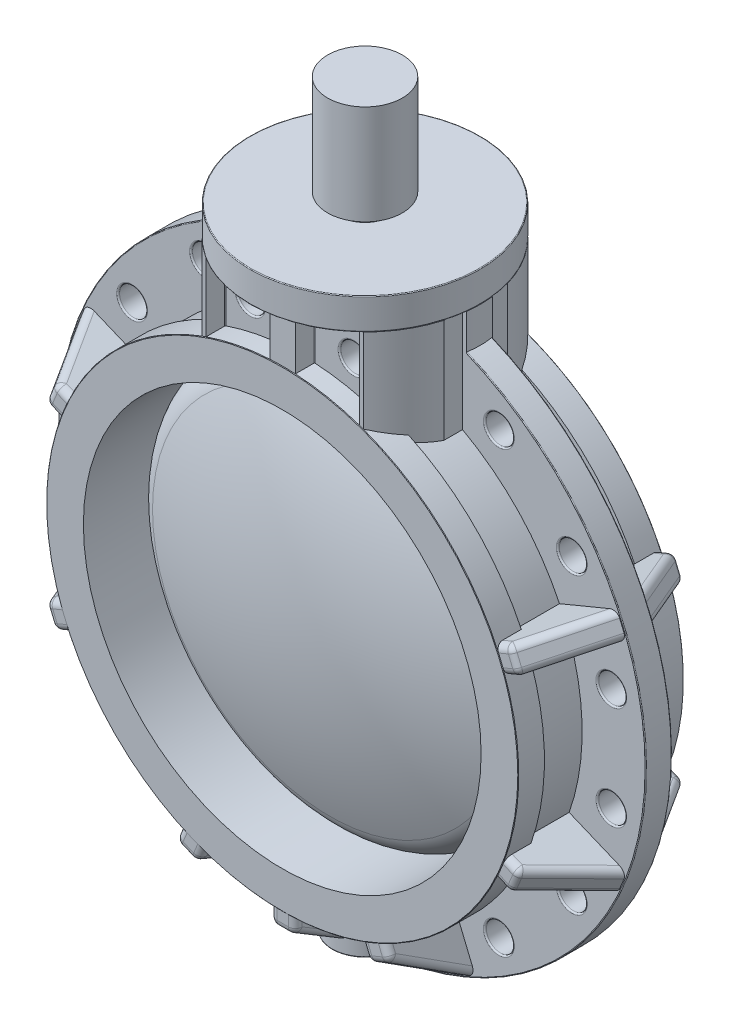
SolidWorks part; units mm, degrees
ref_plane "Front" through (0, 0, 0) normal (0, 0, 1) x (1, 0, 0)
ref_plane "Top" through (0, 0, 0) normal (0, 1, 0) x (1, 0, 0)
ref_plane "Right" through (0, 0, 0) normal (1, 0, 0) x (0, 0, -1)
sketch "Sketch1" plane through (0, 0, 0) normal (0, 0, 1) x (1, 0, 0)
  circle A0 centre (0, 0) radius 299.974
  circle A1 centre (0, 0) radius 207.9625
  dimension "D1" = 599.948
  dimension "D2" = 415.925
extrude "Extrude1" add sketch "Sketch1" along normal mid plane 166.37
ref_plane "Plane1" through (0, 0, 13.335) normal (0, 0, 1) x (1, 0, 0)
sketch "Sketch2" plane through (0, 0, 13.335) normal (0, 0, 1) x (1, 0, 0)
  circle A0 centre (0, 0) radius 299.974 construction
  circle A1 centre (0, 0) radius 299.974
  circle A2 centre (0, 0) radius 234.95
  dimension "D1" = 469.9
extrude "Cut-Extrude1" cut sketch "Sketch2" along normal blind 44.45
sketch "Sketch3" plane through (0, 0, 83.185) normal (0, 0, 1) x (1, 0, 0)
  circle A0 centre (0, 0) radius 240.9063
  circle A1 centre (0, 0) radius 299.974 construction
  circle A2 centre (0, 0) radius 299.974
  dimension "D1" = 481.8126
extrude "Cut-Extrude3" cut sketch "Sketch3" against normal up to next
mirror "Mirror1" about plane through (0, 0, 0) normal (0, 0, 1) of "Cut-Extrude1"
mirror "Mirror2" about plane through (0, 0, 0) normal (0, 0, 1) of "Cut-Extrude3"
sketch "Sketch4" plane through (0, 0, 83.185) normal (0, 0, 1) x (1, 0, 0)
  circle A0 centre (0, 0) radius 240.9063 construction
  circle A1 centre (0, 0) radius 240.9063
  circle A2 centre (0, 0) radius 233.934
  dimension "D1" = 467.868
extrude "Extrude2" add sketch "Sketch4" along normal blind 1.27
mirror "Mirror3" about plane through (0, 0, 0) normal (0, 0, 1) of "Extrude2"
sketch "Sketch5" plane through (0, 0, 83.185) normal (0, 0, 1) x (1, 0, 0)
  circle A0 centre (0, 0) radius 216.4805
  circle A1 centre (0, 0) radius 212.9798
extrude "Cut-Extrude4" cut sketch "Sketch5" against normal blind 1.016
mirror "Mirror4" about plane through (0, 0, 0) normal (0, 0, 1) of "Cut-Extrude4"
fillet "Fillet1" radius 2.54 2 edges at (207.9625, 0, -83.185) (207.9625, 0, 83.185)
ref_plane "Plane2" through (0, -299.974, 0) normal (0, 1, 0) x (-1, 0, 0)
sketch "Sketch6" plane through (0, -299.974, 0) normal (0, 1, 0) x (-1, 0, 0)
  circle A0 centre (0, 0) radius 33.528
  dimension "D1" = 67.056
extrude "Extrude4" add sketch "Sketch6" along normal up to surface (65.024 mm away)
fillet "Fillet2" radius 0.762 9 edges at (0, 299.974, -13.335) (0, 299.974, 13.335) (-30.7621, -265.66, 13.335) (30.7621, -265.66, 13.335) (30.7621, -265.66, -13.335) (-30.7621, -265.66, -13.335) (-33.528, -298.0944, -0.0319) (32.6914, -298.1873, -7.443) (0, -299.974, 33.528)
sketch "Sketch14" plane through (0, 0, 0) normal (1, 0, 0) x (0, 0, -1)
  line L0 (-13.335, 298.1367) -> (-83.947, 255.644)
  line L1 (-13.335, 299.212) -> (-13.335, -297.5748) construction
  line L2 (-13.335, 298.1367) -> (-13.335, 230.4074)
  line L3 (-83.947, 237.9329) -> (-83.947, 255.644)
  line L4 (-84.455, 240.9063) -> (-84.455, -240.9063) construction
  line L5 (-83.947, 237.9329) -> (-57.785, 237.9329)
  line L6 (-57.785, -240.9063) -> (-57.785, 240.9063) construction
  line L7 (-57.785, 230.4074) -> (-57.785, 237.9329)
  line L8 (-57.785, 230.4074) -> (-13.335, 230.4074)
  line L9 (0, 0) -> (0, 313.9315) construction
  line L10 (57.785, 230.4074) -> (13.335, 230.4074)
  line L11 (57.785, 230.4074) -> (57.785, 237.9329)
  line L12 (83.947, 237.9329) -> (57.785, 237.9329)
  line L13 (83.947, 237.9329) -> (83.947, 255.644)
  line L14 (13.335, 298.1367) -> (13.335, 230.4074)
  line L15 (13.335, 298.1367) -> (83.947, 255.644)
  dimension "D1" = 0.508
extrude "Extrude11" add sketch "Sketch14" along normal mid plane 25.7302
pattern_circular "CirPattern1" count 16 over 360 about axis through (0, 0, 57.785) along (0, 0, -1) of "Extrude11"
fillet "Fillet4" radius 7 70 edges at (234.1408, -83.0592, 83.947) (224.2943, -106.8308, 83.947) (260.7366, -94.0755, 48.641) (250.89, -117.8471, 48.641) (236.1842, -97.8307, 83.947) (-250.89, 117.8471, 48.641) (-224.2943, 106.8308, 83.947) (-234.1408, 83.0592, 83.947) (-236.1842, 97.8307, 83.947) (-260.7366, 94.0755, 48.641) (-260.7366, -94.0755, 48.641) (-234.1408, -83.0592, 83.947) (-236.1842, -97.8307, 83.947) (-224.2943, -106.8308, 83.947) (-250.89, -117.8471, 48.641) (-106.8308, -224.2943, 83.947) (-117.8471, -250.89, 48.641) (-94.0755, -260.7366, 48.641) (-83.0592, -234.1408, 83.947) (-97.8307, -236.1842, 83.947) (-12.8651, -248.1033, 83.947) (0, -255.644, 83.947) (12.8651, -248.1033, 83.947) (12.8651, -271.5867, 57.4543) (-12.8651, -271.5867, 57.4543) (94.0755, -260.7366, 48.641) (83.0592, -234.1408, 83.947) (106.8308, -224.2943, 83.947) (97.8307, -236.1842, 83.947) (117.8471, -250.89, 48.641) (250.89, 117.8471, 48.641) (260.7366, 94.0755, 48.641) (236.1842, 97.8307, 83.947) (234.1408, 83.0592, 83.947) (224.2943, 106.8308, 83.947) (234.1408, -83.0592, -83.947) (260.7366, -94.0755, -48.641) (250.89, -117.8471, -48.641) (236.1842, -97.8307, -83.947) (224.2943, -106.8308, -83.947) (250.89, 117.8471, -48.641) (260.7366, 94.0755, -48.641) (236.1842, 97.8307, -83.947) (234.1408, 83.0592, -83.947) (224.2943, 106.8308, -83.947) (-236.1842, -97.8307, -83.947) (-260.7366, -94.0755, -48.641) (-250.89, -117.8471, -48.641) (-224.2943, -106.8308, -83.947) (-234.1408, -83.0592, -83.947) (-224.2943, 106.8308, -83.947) (-234.1408, 83.0592, -83.947) (-260.7366, 94.0755, -48.641) (-236.1842, 97.8307, -83.947) (-250.89, 117.8471, -48.641) (117.8471, -250.89, -48.641) (106.8308, -224.2943, -83.947) (97.8307, -236.1842, -83.947) (83.0592, -234.1408, -83.947) (94.0755, -260.7366, -48.641) (12.8651, -271.5867, -57.4543) (12.8651, -248.1033, -83.947) (0, -255.644, -83.947) (-12.8651, -248.1033, -83.947) (-12.8651, -271.5867, -57.4543) (-117.8471, -250.89, -48.641) (-94.0755, -260.7366, -48.641) (-83.0592, -234.1408, -83.947) (-106.8308, -224.2943, -83.947) (-97.8307, -236.1842, -83.947)
ref_plane "Plane3" through (0, 343.916, 0) normal (0, 1, 0) x (-1, 0, 0)
sketch "Sketch15" plane through (0, 343.916, 0) normal (0, 1, 0) x (-1, 0, 0)
  circle A0 centre (0, 0) radius 117.475
  dimension "D1" = 234.95
extrude "Extrude12" add sketch "Sketch15" against normal blind 31.7119
fillet "Fillet5" radius 0.762 2 edges at (0, 343.916, 117.475) (0, 312.2041, 117.475)
sketch "Sketch7" plane through (0, 0, 0) normal (0, 0, 1) x (1, 0, 0)
  line L0 (0, 0) -> (0, -311.0511) construction
  line L1 (0, 0) -> (0, 317.7785) construction
  line L2 (0, 0) -> (312.9747, 0) construction
  line L3 (0, 0) -> (-322.5752, 0) construction
  line L4 (52.65, 264.6894) -> (0, 0) construction
  circle A0 centre (52.65, 264.6894) radius 14.224
  circle A1 centre (0, 0) radius 269.875 construction
  circle A2 centre (149.9345, 224.3929) radius 14.224
  circle A3 centre (224.3929, 149.9345) radius 14.224
  circle A4 centre (264.6894, 52.65) radius 14.224
  circle A5 centre (264.6894, -52.65) radius 14.224
  circle A6 centre (224.3929, -149.9345) radius 14.224
  circle A7 centre (149.9345, -224.3929) radius 14.224
  circle A8 centre (52.65, -264.6894) radius 14.224
  circle A9 centre (-52.65, -264.6894) radius 14.224
  circle A10 centre (-149.9345, -224.3929) radius 14.224
  circle A11 centre (-224.3929, -149.9345) radius 14.224
  circle A12 centre (-264.6894, -52.65) radius 14.224
  circle A13 centre (-264.6894, 52.65) radius 14.224
  circle A14 centre (-224.3929, 149.9345) radius 14.224
  circle A15 centre (-149.9345, 224.3929) radius 14.224
  circle A16 centre (-52.65, 264.6894) radius 14.224
  dimension "D2" = 539.75
  dimension "D3" = 28.448
  dimension "D1" = 11.25
extrude "Cut-Extrude5" cut sketch "Sketch7" against normal through all and the other way through all
fillet "Fillet3" radius 1.5 28 edges at (-278.9134, 52.65, -13.335) (-250.4654, 52.65, 13.335) (-278.9134, -52.65, -13.335) (-250.4654, -52.65, 13.335) (-238.6169, -149.9345, -13.335) (-210.1689, -149.9345, 13.335) (-164.1585, -224.3929, -13.335) (-135.7105, -224.3929, 13.335) (-66.874, -264.6894, -13.335) (-38.426, -264.6894, 13.335) (38.426, -264.6894, -13.335) (66.874, -264.6894, 13.335) (135.7105, -224.3929, -13.335) (164.1585, -224.3929, 13.335) (210.1689, -149.9345, -13.335) (238.6169, -149.9345, 13.335) (250.4654, -52.65, -13.335) (278.9134, -52.65, 13.335) (250.4654, 52.65, -13.335) (278.9134, 52.65, 13.335) (210.1689, 149.9345, -13.335) (238.6169, 149.9345, 13.335) (135.7105, 224.3929, -13.335) (164.1585, 224.3929, 13.335) (-164.1585, 224.3929, -13.335) (-135.7105, 224.3929, 13.335) (-238.6169, 149.9345, -13.335) (-210.1689, 149.9345, 13.335)
sketch "Sketch16" plane through (0, 312.2041, 0) normal (0, -1, 0) x (1, 0, 0)
  line L1 (0, 0) -> (0, 127.3824) construction
  line L2 (0, 0) -> (-306.6401, 0) construction
  line L3 (12.8651, 76.947) -> (12.8651, 57.785) construction
  line L4 (-12.8651, 76.947) -> (-12.8651, 57.785) construction
  line L5 (12.8651, 83.947) -> (12.8651, -83.947)
  line L6 (-12.8651, 83.947) -> (-12.8651, -83.947)
  line L13 (-12.8651, 83.947) -> (12.8651, 83.947)
  line L25 (-12.8651, -83.947) -> (12.8651, -83.947)
extrude "Extrude13" add sketch "Sketch16" along normal up to body separate body
sketch "Sketch17" plane through (0, 312.2041, 0) normal (0, -1, 0) x (1, 0, 0)
  line L0 (0, 0) -> (0, 126.5358) construction
  line L1 (0, 12.573) -> (0, -12.573) construction
  line L2 (0, 0) -> (166.212, 0) construction
  line L3 (78.1841, 83.947) -> (78.1841, -83.947)
  line L4 (78.1841, 83.947) -> (82.1783, 83.947)
  line L7 (12.8651, 83.947) -> (-12.8651, 83.947) construction
  line L9 (78.1841, -83.947) -> (82.1783, -83.947)
  line L10 (116.7157, 13.335) -> (112.9007, 13.335)
  line L11 (299.212, 13.335) -> (12.8651, 13.335) construction
  line L13 (116.7157, -13.335) -> (112.9007, -13.335)
  line L14 (112.9007, 32.4624) -> (112.9007, 13.335)
  line L15 (112.9007, -13.335) -> (112.9007, -32.4624)
  arc A0 (82.1783, -83.947) -> (112.9007, -32.4624) centre (0, 0) ccw
  arc A1 (116.7157, -13.335) -> (116.7157, 13.335) centre (0, 0) ccw
  arc A2 (112.9007, 32.4624) -> (82.1783, 83.947) centre (0, 0) ccw
  dimension "D1" = 234.95
extrude "Extrude14" add sketch "Sketch17" along normal up to body separate body
mirror "Mirror5" about plane through (0, 0, 0) normal (1, 0, 0) of "Extrude14"
sketch "Sketch18" plane through (0, 0, 0) normal (0, 0, 1) x (1, 0, 0)
  line L0 (-81.0853, 312.2041) -> (81.0853, 312.2041) construction
  line L1 (-78.1841, 312.2041) -> (78.1841, 312.2041)
  line L2 (-78.1841, 227.8664) -> (-78.1841, 312.2041) construction
  line L3 (78.1841, 227.8664) -> (78.1841, 312.2041) construction
  line L4 (-78.1841, 288.8167) -> (-78.1841, 312.2041)
  line L5 (78.1841, 288.8167) -> (78.1841, 312.2041)
  arc A0 (-12.8651, 298.9353) -> (-78.1841, 288.8167) centre (0, 0) ccw construction
  arc A1 (78.1841, 288.8167) -> (-78.1841, 288.8167) centre (0, 0) ccw
extrude "Extrude15" add sketch "Sketch18" along normal mid plane 26.67
chamfer "Chamfer1" distance 24.13 angle 45 2 edges at (0, 312.2041, -83.947) (0, 312.2041, 83.947)
sketch "Sketch19" plane through (0, 0, 13.335) normal (0, 0, 1) x (1, 0, 0)
  line L0 (78.1841, 312.2041) -> (78.1841, 221.5598) construction
  line L1 (-78.1841, 312.2041) -> (-78.1841, 221.5598) construction
  line L2 (78.1841, 221.5598) -> (78.1841, 288.8167)
  line L3 (-78.1841, 221.5598) -> (-78.1841, 288.8167)
  arc A0 (-116.7157, 275.5091) -> (-31.2583, -297.5748) centre (0, 0) ccw construction
  arc A1 (78.1841, 288.8167) -> (-78.1841, 288.8167) centre (0, 0) ccw
  arc A3 (-12.8651, 234.5975) -> (-78.1841, 221.5598) centre (0, 0) ccw construction
  arc A4 (78.1841, 221.5598) -> (-78.1841, 221.5598) centre (0, 0) ccw
extrude "Extrude16" add sketch "Sketch19" along normal blind 51.0794
mirror "Mirror6" about plane through (0, 0, 0) normal (0, 0, 1) of "Extrude16"
fillet "Fillet6" radius 0.762 20 edges at (-12.8651, 298.9353, 38.8747) (-78.1841, 288.8167, 38.8747) (12.8651, 298.9353, 38.8747) (78.1841, 288.8167, 38.8747) (12.8651, 269.7489, 64.4144) (78.1841, 258.3415, 64.4144) (-78.1841, 258.3415, 64.4144) (-12.8651, 269.7489, 64.4144) (-45.8049, 295.6852, 64.4144) (45.8049, 295.6852, 64.4144) (-78.1841, 288.8167, -38.8747) (-12.8651, 298.9353, -38.8747) (12.8651, 298.9353, -38.8747) (78.1841, 288.8167, -38.8747) (-78.1841, 258.3415, -64.4144) (-12.8651, 269.7489, -64.4144) (12.8651, 269.7489, -64.4144) (78.1841, 258.3415, -64.4144) (-45.8049, 295.6852, -64.4144) (45.8049, 295.6852, -64.4144)
sketch "Sketch20" plane through (0, 0, 0) normal (0, 0, 1) x (1, 0, 0)
  circle A1 centre (-52.65, 264.6894) radius 14.224
  circle A2 centre (52.65, 264.6894) radius 14.224
  dimension "D1" = 28.448
extrude "Cut-Extrude6" cut sketch "Sketch20" against normal through all and the other way through all
fillet "Fillet7" radius 1.5 4 edges at (66.874, 264.6894, 64.4144) (38.426, 264.6894, -64.4144) (-38.426, 264.6894, 64.4144) (-66.874, 264.6894, -64.4144)
sketch "Sketch21" plane through (0, 312.2041, 0) normal (0, -1, 0) x (1, 0, 0)
  circle A0 centre (0, 0) radius 36.5125
  dimension "D1" = 73.025
extrude "Extrude17" add sketch "Sketch21" along normal blind 25.4
sketch "Sketch22" plane through (0, 0, 0) normal (0, 1, 0) x (1, 0, 0)
  line L0 (0, 0) -> (0, 135.8998) construction
  line L1 (0, -12.573) -> (0, 12.573) construction
  line L2 (0, 63.6524) -> (0, 13.335) construction
  line L3 (0, 0) -> (317.8362, 0) construction
  line L4 (202.946, 3.4716) -> (202.946, -3.4716)
  line L5 (0, -70.6368) -> (0, 70.6368)
  line L7 (0, 0) -> (-200.7982, 0) construction
  arc A0 (180.948, 35.9161) -> (0, 70.6368) centre (0, -418.2313) ccw
  arc A1 (180.948, -35.9161) -> (0, -70.6368) centre (0, 418.2313) cw
  arc A2 (202.946, 3.4716) -> (180.948, 35.9161) centre (168.021, 3.4716) ccw
  arc A3 (202.946, -3.4716) -> (180.948, -35.9161) centre (168.021, -3.4716) cw
  point P20 (202.946, 26.5214)
  point P23 (202.946, -26.5214)
  dimension "D2" = 34.925
  dimension "D1" = 202.946
revolve "Revolve1" add sketch "Sketch22" angle 360 about L0
sketch "Sketch23" plane through (0, 0, 0) normal (0, 0, 1) x (1, 0, 0)
  circle A0 centre (0, 0) radius 202.946
  circle A1 centre (0, 0) radius 234.95
  dimension "D1" = 405.892
  dimension "D2" = 469.9
extrude "Extrude18" add sketch "Sketch23" along normal mid plane 168.91
chamfer "Chamfer2" distance 0.508 angle 45 2 edges at (240.9063, 0, 84.455) (240.9063, 0, -84.455)
sketch "Sketch24" plane through (0, 343.916, 0) normal (0, 1, 0) x (1, 0, 0)
  circle A0 centre (0, 0) radius 25.4
  dimension "D1" = 50.8
extrude "Extrude19" add sketch "Sketch24" along normal blind 9.525
sketch "Sketch25" plane through (0, 353.441, 0) normal (0, 1, 0) x (1, 0, 0)
  circle A0 centre (0, 0) radius 38.1
  dimension "D1" = 76.2
extrude "Extrude20" add sketch "Sketch25" along normal blind 101.6
